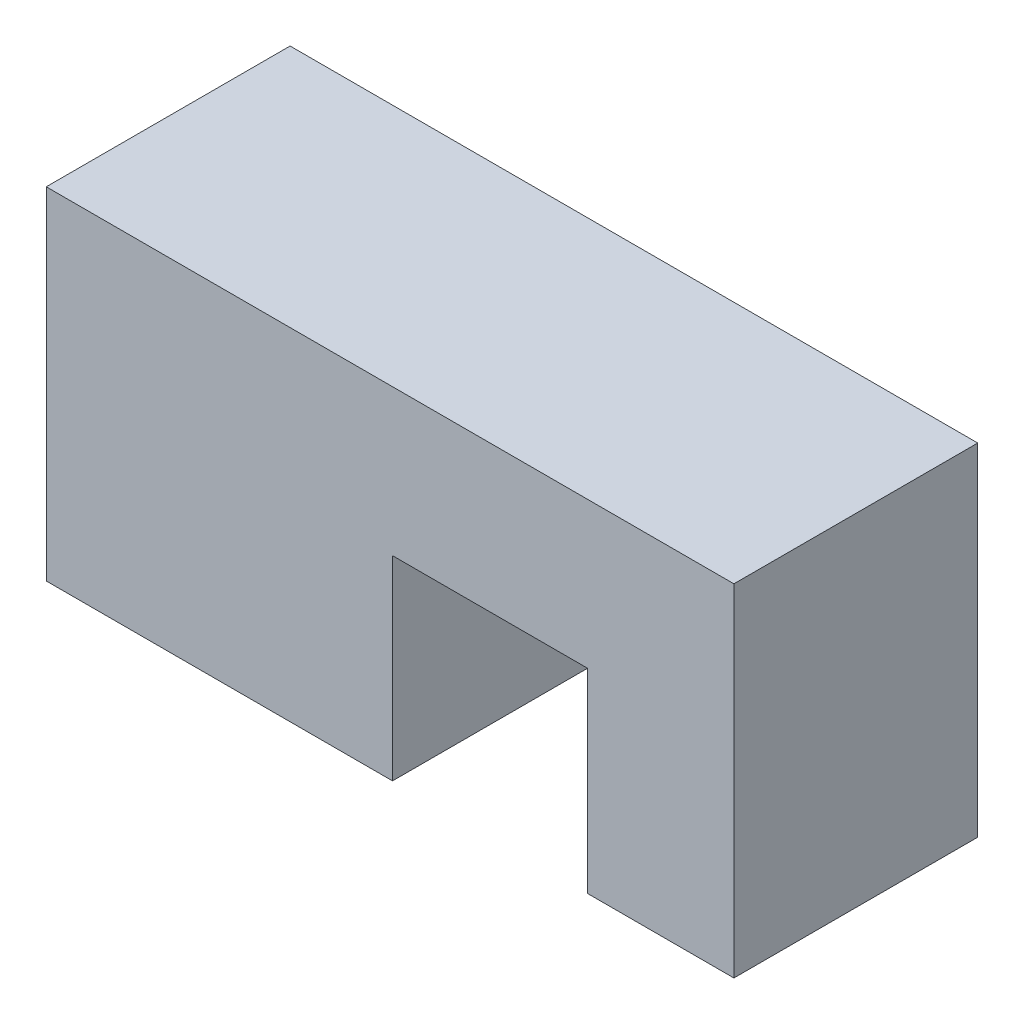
SolidWorks part; units mm, degrees
ref_plane "Alzado" through (0, 0, 0) normal (0, 0, 1) x (1, 0, 0)
ref_plane "Planta" through (0, 0, 0) normal (0, 1, 0) x (1, 0, 0)
ref_plane "Vista lateral" through (0, 0, 0) normal (1, 0, 0) x (0, 0, -1)
sketch "Sketch1" plane through (0, 0, 0) normal (0, 0, 1) x (1, 0, 0)
  line L0 (0, 0) -> (0, 20)
  line L1 (0, 20) -> (20, 20)
  line L2 (20, 20) -> (20, 29.4342) construction
  line L3 (20, 35) -> (-35.5, 35)
  line L4 (-35.5, 35) -> (-35.5, 0)
  line L5 (-35.5, 0) -> (0, 0)
  line L6 (20, 20) -> (20, 0)
  line L7 (20, 0) -> (35, 0)
  line L8 (35, 0) -> (35, 35)
  line L9 (35, 35) -> (20, 35)
  dimension "D1" = 35.5
  dimension "D2" = 20
  dimension "D3" = 20
  dimension "D4" = 15
  dimension "D5" = 15
extrude "Boss-Extrude1" add sketch "Sketch1" along normal blind 25
